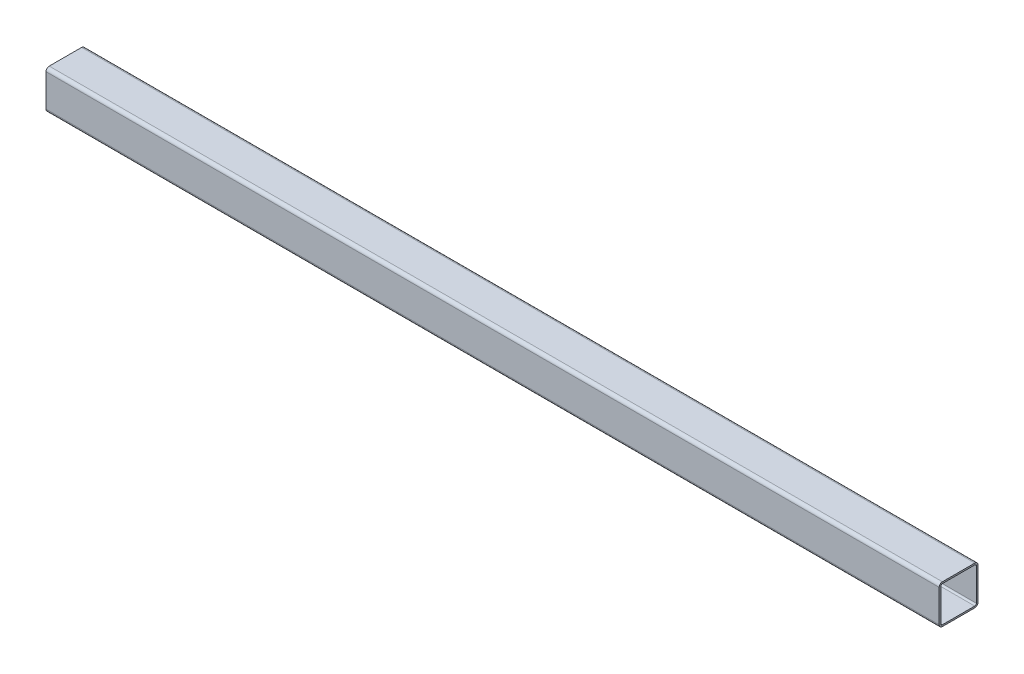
SolidWorks part; units mm, degrees
ref_plane "Front Plane" through (0, 0, 0) normal (1, 0, 0) x (0, 1, 0)
ref_plane "Top Plane" through (0, 0, 0) normal (0, 0, 1) x (0, 1, 0)
ref_plane "Right Plane" through (0, 0, 0) normal (0, 1, 0) x (-1, 0, 0)
sketch "Sketch1" plane through (0, 0, 0) normal (1, 0, 0) x (0, 1, 0)
  point P0 (0, 0)
  line B0 (-63.5, -76.2) -> (63.5, -76.2)
  line B1 (-76.2, -63.5) -> (-76.2, 63.5)
  line B2 (63.5, 76.2) -> (-63.5, 76.2)
  line B3 (76.2, 63.5) -> (76.2, -63.5)
  line B4 (-63.5, 63.5) -> (63.5, -63.5) construction
  line B5 (69.85, 63.5) -> (69.85, -63.5)
  line B6 (-63.5, -69.85) -> (63.5, -69.85)
  line B7 (-69.85, -63.5) -> (-69.85, 63.5)
  line B8 (63.5, 69.85) -> (-63.5, 69.85)
  arc B9 (76.2, 63.5) -> (63.5, 76.2) centre (63.5, 63.5) ccw
  arc B10 (63.5, -76.2) -> (76.2, -63.5) centre (63.5, -63.5) ccw
  arc B11 (-76.2, -63.5) -> (-63.5, -76.2) centre (-63.5, -63.5) ccw
  arc B12 (-63.5, 76.2) -> (-76.2, 63.5) centre (-63.5, 63.5) ccw
  arc B13 (63.5, -69.85) -> (69.85, -63.5) centre (63.5, -63.5) ccw
  arc B14 (-69.85, -63.5) -> (-63.5, -69.85) centre (-63.5, -63.5) ccw
  arc B15 (-63.5, 69.85) -> (-69.85, 63.5) centre (-63.5, 63.5) ccw
  arc B16 (69.85, 63.5) -> (63.5, 69.85) centre (63.5, 63.5) ccw
sketch_block_instance "6in 0.25in beam-1"
sketch_block "6in 0.25in beam" parameters "D1"=12.7, "D2"=152.4, "D3"=152.4, "D4"=6.35, "D5"=6.35, "D6"=6.35, "D7"=6.35, "D8"=6.35, "D9"=101.6
extrude "Boss-Extrude1" add sketch "Sketch1" along normal blind 7315.2
sketch "Sketch2" plane through (0, 0, 0) normal (0, 0, 1) x (0, 1, 0)
  line L0 (63.5, -7315.2) -> (-63.5, -7315.2) construction
  line L1 (-1217.9372, -3505.2) -> (1292.2184, -3505.2)
  line L2 (-1217.9372, -3505.2) -> (-1217.9372, -7620)
  line L3 (-1217.9372, -7620) -> (1292.2184, -7620)
  line L4 (1292.2184, -3505.2) -> (1292.2184, -7620)
  line L5 (63.5, 0) -> (-63.5, 0) construction
  dimension "D1" = 304.8
  dimension "D2" = 3505.2
extrude "Cut-Extrude1" cut sketch "Sketch2" against normal through all both and the other way through all
ref_plane "Mid YZ 24ft" [suppressed] through (3657.6, 0, 0) normal (1, 0, 0) x (0, 1, 0)
sketch "Sketch3" [suppressed] plane through (0, 0, 0) normal (0, 0, 1) x (0, 1, 0)
  line L0 (88.9, -7315.2) -> (-88.9, -7315.2) construction
  line L1 (-1026.1451, -5378.45) -> (1446.2046, -5378.45)
  line L2 (-1026.1451, -5378.45) -> (-1026.1451, -5594.35)
  line L3 (-1026.1451, -5594.35) -> (1446.2046, -5594.35)
  line L4 (1446.2046, -5378.45) -> (1446.2046, -5594.35)
  line L5 (-930.1316, -1720.85) -> (1650.2334, -1720.85)
  line L6 (-930.1316, -1720.85) -> (-930.1316, -1936.75)
  line L7 (-930.1316, -1936.75) -> (1650.2334, -1936.75)
  line L8 (1650.2334, -1720.85) -> (1650.2334, -1936.75)
  point P8 (1650.2334, -1828.8)
  point P12 (1446.2046, -5486.4)
  point P13 (-1026.1451, -5486.4)
  point P14 (-930.1316, -1828.8)
  dimension "D1" = 1828.8
  dimension "D2" = 1828.8
  dimension "D3" = 3657.6
  dimension "D4" = 215.9
  dimension "D5" = 215.9
sketch "Sketch5"
sketch_block_instance "blk 6x6x0.25-1"
sketch_block "blk 6x6x0.25" parameters "D1"=12.7, "D2"=6.35, "D3"=6.35, "D4"=6.35, "D5"=152.4, "D6"=152.4, "D7"=139.7, "D8"=139.7
